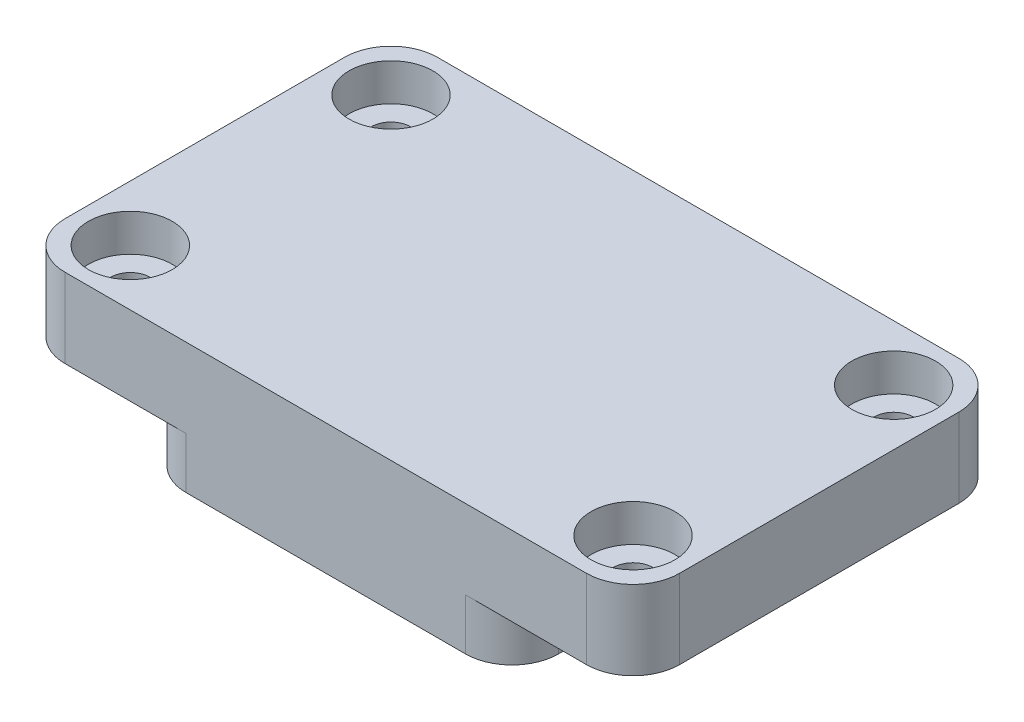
SolidWorks part; units mm, degrees
ref_plane "Front" through (0, 0, 0) normal (0, 0, 1) x (1, 0, 0)
ref_plane "Top" through (0, 0, 0) normal (0, 1, 0) x (1, 0, 0)
ref_plane "Right" through (0, 0, 0) normal (1, 0, 0) x (0, 0, -1)
sketch "Sketch1" plane through (0, 0, 0) normal (0, 1, 0) x (1, 0, 0)
  line L1 (-7.5, -10) -> (7.5, -10)
  line L2 (-10, -7.5) -> (-10, 7.5)
  line L3 (-7.5, 10) -> (7.5, 10)
  line L4 (10, -7.5) -> (10, 7.5)
  line L5 (-10, -10) -> (10, 10) construction
  line L6 (-10, 10) -> (10, -10) construction
  arc A0 (-10, 7.5) -> (-7.5, 10) centre (-7.5, 7.5) cw
  arc A1 (10, 7.5) -> (7.5, 10) centre (7.5, 7.5) ccw
  arc A2 (-7.5, -10) -> (-10, -7.5) centre (-7.5, -7.5) cw
  arc A3 (7.5, -10) -> (10, -7.5) centre (7.5, -7.5) ccw
  point P0 (0, 0)
  dimension "D3" = 2.5
  dimension "D1" = 20
  dimension "D2" = 20
extrude "Boss-Extrude1" add sketch "Sketch1" along normal blind 7
sketch "Sketch3" plane through (0, 0, 0) normal (0, -1, 0) x (1, 0, 0)
  line L1 (-3.2, -7.6) -> (5.1858, -7.6)
  line L2 (-7.6, -3.2) -> (-7.6, 5.1858)
  line L3 (-5.1858, 7.6) -> (3.2, 7.6)
  line L4 (7.6, -5.1858) -> (7.6, 3.2)
  line L5 (-7.6, -7.6) -> (7.6, 7.6) construction
  line L6 (-7.6, 7.6) -> (7.6, -7.6) construction
  line L8 (4.2, 6.6) -> (4.2, 5.5)
  line L9 (-7.3071, 5.8929) -> (-5.8929, 7.3071)
  line L10 (5.8929, -7.3071) -> (7.3071, -5.8929)
  line L11 (5.5, 4.2) -> (6.6, 4.2)
  line L12 (4.2, 7.6) -> (7.6, 7.6) construction
  line L13 (7.6, 7.6) -> (7.6, 4.2) construction
  line L14 (-6.6, -4.2) -> (-5.5, -4.2)
  line L15 (-4.2, -5.5) -> (-4.2, -6.6)
  line L16 (-7.6, -4.2) -> (-7.6, -7.6) construction
  line L17 (-4.2, -7.6) -> (-7.6, -7.6) construction
  line L18 (10, 7.5) -> (10, -7.5) construction
  line L19 (-7.5, 10) -> (7.5, 10) construction
  arc A2 (4.2, 5.5) -> (5.5, 4.2) centre (5.5, 5.5) ccw
  arc A3 (-5.5, -4.2) -> (-4.2, -5.5) centre (-5.5, -5.5) cw
  arc A4 (7.6, 3.2) -> (6.6, 4.2) centre (6.6, 3.2) ccw
  arc A5 (4.2, 6.6) -> (3.2, 7.6) centre (3.2, 6.6) ccw
  arc A6 (-6.6, -4.2) -> (-7.6, -3.2) centre (-6.6, -3.2) cw
  arc A7 (-3.2, -7.6) -> (-4.2, -6.6) centre (-3.2, -6.6) cw
  arc A8 (7.6, -5.1858) -> (7.3071, -5.8929) centre (6.6, -5.1858) cw
  arc A9 (5.8929, -7.3071) -> (5.1858, -7.6) centre (5.1858, -6.6) cw
  arc A10 (-7.6, 5.1858) -> (-7.3071, 5.8929) centre (-6.6, 5.1858) cw
  arc A11 (-5.1858, 7.6) -> (-5.8929, 7.3071) centre (-5.1858, 6.6) ccw
  point P1 (0, 0)
  point P38 (7.6, -5.6)
  point P41 (5.6, -7.6)
  point P44 (-7.6, 5.6)
  point P47 (-5.6, 7.6)
  point P48 (0, 0)
  dimension "D4" = 1.3
  dimension "D5" = 1
  dimension "D1" = 2.4
  dimension "D2" = 2.4
  dimension "D3" = 2.1
hole_wizard "M1.6 Tapped Hole1" positions "Sketch6" profile "Sketch8" tap size "M1.6" standard "ISO"
sketch "Sketch6" plane through (0, 0, 0) normal (0, -1, 0) x (-1, 0, 0)
  point P0 (-5.5, -5.5)
  point P3 (5.5, 5.5)
sketch "Sketch8" plane through (5.5, 0, 5.5) normal (1, 0, 0) x (0, 0, -1)
  line L0 (0, 0) -> (0, 5.6255)
  line L1 (0, 5.6255) -> (0.625, 5.25)
  line L2 (0.625, 5.25) -> (0.625, 0)
  line L5 (0.625, 0) -> (0, 0)
  line L10 (0, 5.6255) -> (-0.625, 5.25) construction
  line L11 (0, -6.35) -> (0, 107.95) construction
  dimension "Tap Drill Dia." = 1.25
  dimension "Tap Drill Depth" = 5.25
  dimension "Drill Angle" = 118
sketch "Sketch9" plane through (10, 0, 0) normal (1, 0, 0) x (0, 0, -1)
  line L0 (-6.125, 0) -> (-4.875, 0) construction
  line L2 (0.6, 1.85) -> (0.6, 0) construction
  line L4 (10, 7) -> (10, 0) construction
  line L8 (-2.7, 0) -> (-2.7, 1.85)
  line L9 (-2.7, 0) -> (3.9, 0)
  line L10 (3.9, 1.85) -> (3.9, 0)
  line L11 (-2.7, 1.85) -> (3.9, 1.85)
  dimension "D1" = 6.6
  dimension "D2" = 1.85
  dimension "D3" = 9.4
extrude "Cut-Extrude3" cut sketch "Sketch9" against normal blind 4.25
sketch "Sketch10" plane through (0, 7, 0) normal (0, 1, 0) x (1, 0, 0)
  line L0 (-7.5, -10) -> (7.5, -10) construction
  line L2 (7.5, 10) -> (-7.5, 10) construction
  line L3 (-10, 7.5) -> (-10, -7.5) construction
  line L4 (10, -7.5) -> (10, 7.5) construction
  point P0 (-8, 8)
  point P1 (8, -8)
  point P3 (-8, -8)
  point P4 (8, 8)
  point P12 (0, 0)
  point P13 (0, 0)
  dimension "D1" = 2
  dimension "D2" = 2
  dimension "D3" = 2
  dimension "D4" = 2
  dimension "D5" = 2
  dimension "D6" = 2
  dimension "D7" = 2
  dimension "D8" = 2
sketch "Sketch14" plane through (0, 7, 0) normal (0, 1, 0) x (1, 0, 0)
  line L0 (7.5, 10) -> (14, 10)
  line L2 (16.5, 7.5) -> (16.5, -7.5)
  line L4 (-16.5, 7.5) -> (-16.5, -7.5)
  line L5 (16.5, 10) -> (-16.5, -10) construction
  line L6 (16.5, -10) -> (-16.5, 10) construction
  line L7 (14, -10) -> (7.5, -10)
  line L8 (-14, 10) -> (-7.5, 10)
  line L9 (-7.5, -10) -> (7.5, -10) construction
  line L10 (7.5, 10) -> (-7.5, 10) construction
  line L11 (-10, 7.5) -> (-10, -7.5)
  line L12 (-7.5, -10) -> (7.5, -10)
  line L13 (10, -7.5) -> (10, 7.5)
  line L14 (7.5, 10) -> (-7.5, 10)
  line L15 (-10, 7.5) -> (-10, -7.5)
  line L17 (10, -7.5) -> (10, 7.5)
  line L19 (-7.5, 10) -> (7.5, 10) construction
  line L20 (-7.5, -10) -> (-14, -10)
  line L21 (7.5, -10) -> (-7.5, -10) construction
  arc A0 (-16.5, 7.5) -> (-14, 10) centre (-14, 7.5) cw
  arc A1 (-16.5, -7.5) -> (-14, -10) centre (-14, -7.5) ccw
  arc A2 (16.5, -7.5) -> (14, -10) centre (14, -7.5) cw
  arc A3 (14, 10) -> (16.5, 7.5) centre (14, 7.5) cw
  arc A8 (-7.5, 10) -> (-10, 7.5) centre (-7.5, 7.5) ccw
  arc A9 (-10, -7.5) -> (-7.5, -10) centre (-7.5, -7.5) ccw
  arc A10 (7.5, -10) -> (10, -7.5) centre (7.5, -7.5) ccw
  arc A11 (10, 7.5) -> (7.5, 10) centre (7.5, 7.5) ccw
  arc A12 (-7.5, 10) -> (-10, 7.5) centre (-7.5, 7.5) ccw
  arc A13 (-10, -7.5) -> (-7.5, -10) centre (-7.5, -7.5) ccw
  arc A14 (7.5, -10) -> (10, -7.5) centre (7.5, -7.5) ccw
  arc A15 (10, 7.5) -> (7.5, 10) centre (7.5, 7.5) ccw
  point P0 (0, 0)
  dimension "D2" = 2.5
  dimension "D1" = 33
  dimension "D3" = 0
extrude "Boss-Extrude2" add sketch "Sketch14" against normal blind 4.25
sketch "Sketch15" plane through (0, 7, 0) normal (0, 1, 0) x (1, 0, 0)
  line L1 (13.5, 7) -> (-13.5, 7) construction
  line L2 (13.5, 7) -> (13.5, -7) construction
  line L3 (13.5, -7) -> (-13.5, -7) construction
  line L4 (-13.5, 7) -> (-13.5, -7) construction
  line L5 (13.5, 7) -> (-13.5, -7) construction
  line L6 (13.5, -7) -> (-13.5, 7) construction
  point P0 (0, 0)
  dimension "D1" = 27
  dimension "D2" = 14
hole_wizard "CBORE for M2 Pan Head Screw1" positions "Sketch16" profile "Sketch17" counterbore size "M2" standard "ISO"
sketch "Sketch16" plane through (0, 7, 0) normal (0, 1, 0) x (1, 0, 0)
  point P0 (13.5, -7)
  point P3 (-13.5, -7)
  point P6 (-13.5, 7)
  point P9 (13.5, 7)
sketch "Sketch17" plane through (13.5, 7, 7) normal (1, 0, 0) x (0, 0, 1)
  line L0 (0, 0) -> (0, 7)
  line L1 (0, 7) -> (1.05, 7)
  line L3 (1.05, 7) -> (1.05, 2)
  line L4 (1.05, 2) -> (2.25, 2)
  line L5 (2.25, 2) -> (2.25, 0)
  line L7 (2.25, 0) -> (0, 0)
  line L11 (0, -6.35) -> (0, 107.95) construction
  dimension "Thru Hole Dia." = 2.1
  dimension "Thru Hole Depth" = 7
  dimension "C'Bore Dia." = 4.5
  dimension "C'Bore Depth" = 2
